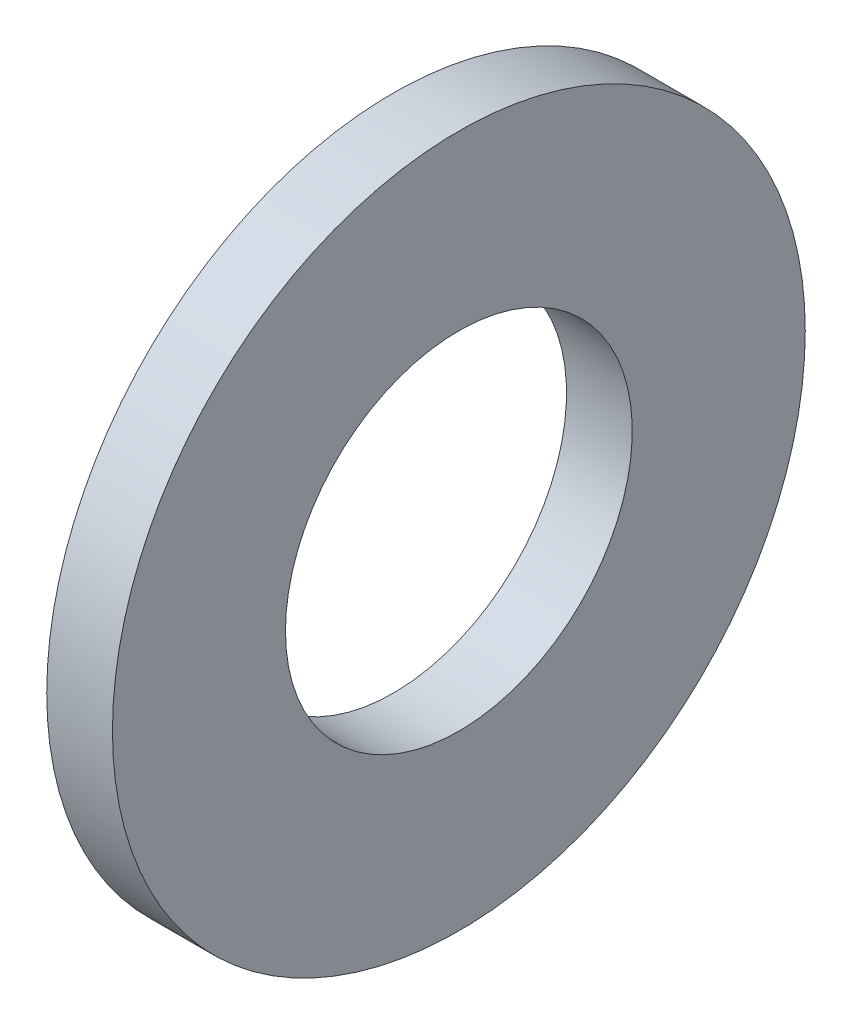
SolidWorks part; units mm, degrees
ref_plane "Plane1" through (0, 0, 0) normal (0, 0, 1) x (1, 0, 0)
ref_plane "Plane2" through (0, 0, 0) normal (0, 1, 0) x (1, 0, 0)
ref_plane "Plane3" through (0, 0, 0) normal (1, 0, 0) x (0, 0, -1)
revolve "Base-Revolve" add sketch "Sketch1" angle 360 about L0
sketch "Sketch1" plane through (0, 0, 0) normal (0, 0, 1) x (1, 0, 0)
  line L0 (-34.925, 0) -> (9.525, 0) construction
  line L1 (0, 5.5626) -> (0, 11.1125)
  line L2 (0, 11.1125) -> (-2.1082, 11.1125)
  line L3 (-2.1082, 11.1125) -> (-2.1082, 5.5626)
  line L4 (-2.1082, 5.5626) -> (0, 5.5626)
  dimension "Thickness" = 2.1082
  dimension "Inside_dia" = 11.1252
  dimension "Outside_dia" = 22.225
